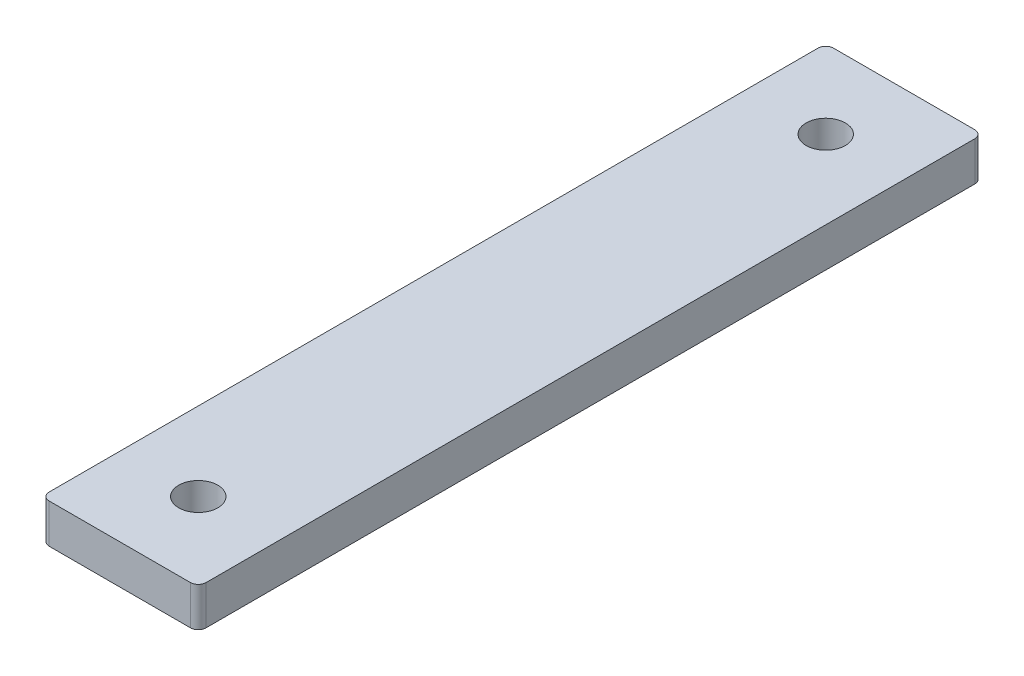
SolidWorks part; units mm, degrees
ref_plane "Front Plane" through (0, 0, 0) normal (0, 0, 1) x (1, 0, 0)
ref_plane "Top Plane" through (0, 0, 0) normal (0, 1, 0) x (1, 0, 0)
ref_plane "Right Plane" through (0, 0, 0) normal (1, 0, 0) x (0, 0, -1)
sketch "Sketch1" plane through (0, 0, 0) normal (0, 1, 0) x (1, 0, 0)
  line L1 (0, 0) -> (20, 0)
  line L2 (0, 0) -> (0, 100)
  line L3 (0, 100) -> (20, 100)
  line L4 (20, 0) -> (20, 100)
  circle A0 centre (10, 10) radius 2.5
  circle A1 centre (10, 90) radius 2.5
  dimension "D1" = 5
  dimension "D2" = 10
  dimension "D3" = 10
  dimension "D4" = 10
  dimension "D5" = 5
  dimension "D6" = 10
  dimension "D7" = 10
  dimension "D8" = 80
extrude "Boss-Extrude1" add sketch "Sketch1" along normal blind 5
fillet "Fillet1" radius 1 4 edges at (20, 2.5, 0) (0, 2.5, 0) (20, 2.5, -100) (0, 2.5, -100)
